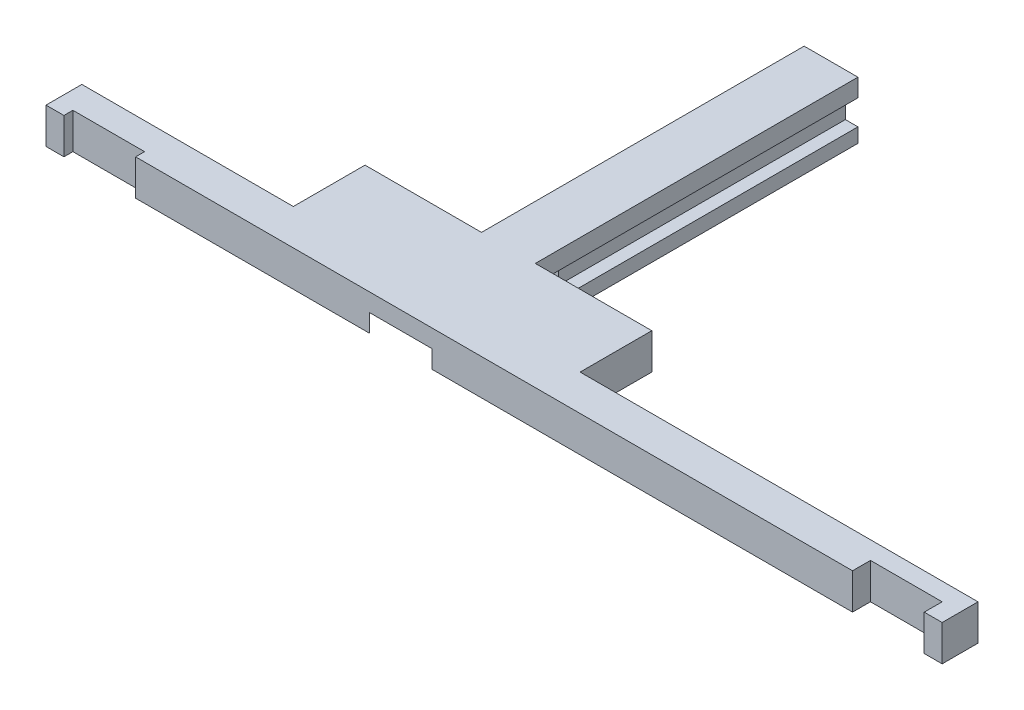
SolidWorks part; units mm, degrees
ref_plane "前视基准面" through (0, 0, 0) normal (0, 0, 1) x (1, 0, 0)
ref_plane "上视基准面" through (0, 0, 0) normal (0, 1, 0) x (1, 0, 0)
ref_plane "右视基准面" through (0, 0, 0) normal (1, 0, 0) x (0, 0, -1)
other "Configuration Table"
sketch "草图2" plane through (0, 0, 0) normal (0, 1, 0) x (1, 0, 0)
  line L0 (-74, 33.377) -> (-74, -48.7019) construction
  line L1 (-99, 30) -> (151, 30)
  line L2 (-99, 30) -> (-99, 0)
  line L5 (151, 30) -> (151, 0)
  line L6 (146, 0) -> (146, 5)
  line L7 (-74, 2.5) -> (-94, 2.5)
  line L8 (-94, 2.5) -> (-94, 0)
  line L10 (0, 0) -> (-148.1012, 0) construction
  line L11 (-74, 2.5) -> (-74, 0)
  line L12 (0, 0) -> (0, -39.3988) construction
  line L17 (0, 0) -> (155.0364, 0) construction
  line L18 (-99, 0) -> (-94, 0)
  line L19 (-74, 0) -> (126, 0)
  line L21 (146, 5) -> (126, 5)
  line L22 (126, 5) -> (126, 0)
  line L23 (146, 0) -> (151, 0)
  dimension "D1" = 2.5
  dimension "D6" = 225
  dimension "D2" = 5
  dimension "D3" = 74
  dimension "D4" = 20
  dimension "D5" = 30
  dimension "D7" = 20
  dimension "D8" = 5
  dimension "D9" = 5
extrude "凸台-拉伸1" add sketch "草图2" along normal blind 10
sketch "草图3" plane through (0, 10, 0) normal (0, 1, 0) x (1, 0, 0)
  line L0 (-74, 0) -> (126, 0) construction
  line L1 (0, 18) -> (0, 0) construction
  circle A0 centre (0, 18) radius 20
  dimension "D2" = 40
  dimension "D1" = 18
extrude "切除-拉伸1" cut sketch "草图3" along normal blind 5 from offset 10
sketch "草图4" plane through (0, 10, 0) normal (0, 1, 0) x (1, 0, 0)
  line L0 (-99, 10) -> (-40, 10)
  line L1 (-99, 30) -> (-99, 0) construction
  line L2 (151, 10) -> (40, 10)
  line L3 (151, 0) -> (151, 30) construction
  line L4 (-74, 0) -> (126, 0) construction
  line L5 (151, 10) -> (151, 30)
  line L6 (151, 30) -> (40, 30)
  line L7 (-99, 30) -> (-99, 10)
  line L8 (151, 30) -> (-99, 30) construction
  line L9 (-40, 10) -> (-40, 30)
  line L10 (40, 10) -> (40, 30)
  line L11 (-40, 30) -> (-99, 30)
  dimension "D1" = 80
  dimension "D2" = 10
  dimension "D3" = 111
  dimension "D4" = 20
extrude "切除-拉伸2" cut sketch "草图4" against normal blind 10
sketch "草图5" plane through (0, 0, 0) normal (0, -1, 0) x (1, 0, 0)
  line L0 (0, -18) -> (-42.0168, -18) construction
  line L1 (0, -18) -> (0, -37.4381) construction
  circle A0 centre (-30, -18) radius 2
  circle A1 centre (30, -18) radius 2
  dimension "D1" = 4
  dimension "D2" = 30
extrude "凸台-拉伸2" add sketch "草图5" along normal blind 10
sketch "草图6" plane through (0, 0, -30) normal (0, 0, -1) x (-1, 0, 0)
  line L0 (-7.5, 10) -> (-7.5, 5)
  line L1 (0, 10) -> (0, 2.7319) construction
  line L2 (-40, 10) -> (40, 10) construction
  line L3 (7.5, 10) -> (-7.5, 10)
  line L4 (-16, 5) -> (16, 5) construction
  line L5 (-7.5, 5) -> (7.5, 5)
  line L6 (7.5, 10) -> (7.5, 5)
  point P12 (0, 5)
  dimension "D1" = 7.5
extrude "凸台-拉伸3" add sketch "草图6" along normal blind 10
sketch "草图8" plane through (0, 0, -40) normal (0, 0, -1) x (-1, 0, 0)
  line L0 (-7.5, 10) -> (7.5, 10)
  line L1 (-7.5, 10) -> (-7.5, 5)
  line L2 (-7.5, 10) -> (-7.5, 5) construction
  line L3 (-7.5, 5) -> (-4, 5)
  line L4 (-4, 5) -> (-4, -2)
  line L5 (-4, -2) -> (-7.5, -2)
  line L6 (-7.5, -2) -> (-7.5, -6)
  line L7 (-7.5, -6) -> (7.5, -6)
  line L8 (0, 10) -> (0, -6) construction
  line L10 (7.5, 5) -> (4, 5)
  line L11 (7.5, 10) -> (7.5, 5)
  line L12 (4, 5) -> (4, -2)
  line L13 (4, -2) -> (7.5, -2)
  line L14 (7.5, -2) -> (7.5, -6)
  dimension "D1" = 16
  dimension "D2" = 5
  dimension "D3" = 7
  dimension "D4" = 3.5
extrude "凸台-拉伸4" add sketch "草图8" along normal blind 80
